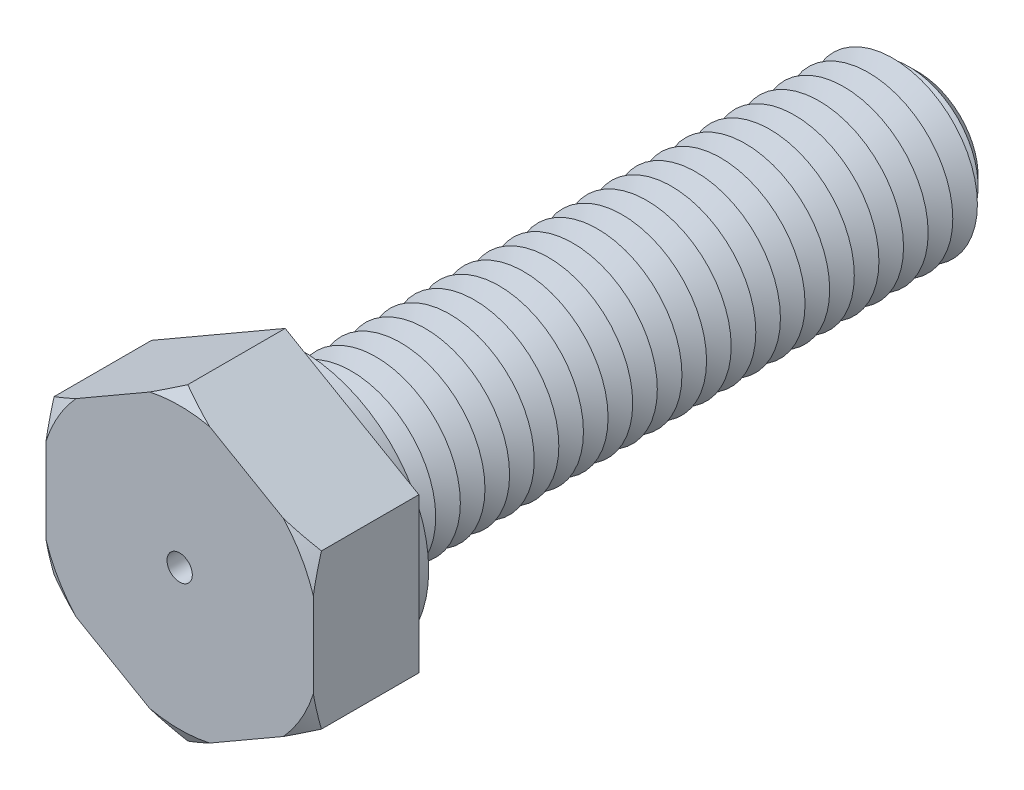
SolidWorks part; units mm, degrees
ref_plane "Front Plane" through (0, 0, 0) normal (0, 0, 1) x (1, 0, 0)
ref_plane "Top Plane" through (0, 0, 0) normal (0, 1, 0) x (1, 0, 0)
ref_plane "Right Plane" through (0, 0, 0) normal (1, 0, 0) x (0, 0, -1)
sketch "Sketch2" plane through (0, 0, 0) normal (0, 0, 1) x (1, 0, 0)
  line L1 (0, 10.9697) -> (-9.5, 5.4848)
  line L2 (-9.5, 5.4848) -> (-9.5, -5.4848)
  line L3 (-9.5, -5.4848) -> (0, -10.9697)
  line L4 (0, -10.9697) -> (9.5, -5.4848)
  line L5 (9.5, -5.4848) -> (9.5, 5.4848)
  line L6 (9.5, 5.4848) -> (0, 10.9697)
  circle A0 centre (0, 0) radius 9.5 construction
  dimension "D1" = 19
extrude "Boss-Extrude1" add sketch "Sketch2" along normal blind 7.5
sketch "Sketch3" plane through (0, 0, 0) normal (0, 0, -1) x (-1, 0, 0)
  circle A0 centre (0, 0) radius 6
  dimension "D1" = 12
extrude "Boss-Extrude2" add sketch "Sketch3" along normal blind 45
sketch "Sketch4" plane through (0, 0, 0) normal (0, 0, -1) x (-1, 0, 0)
  circle A0 centre (0, 0) radius 9
  dimension "D1" = 18
extrude "Boss-Extrude3" add sketch "Sketch4" along normal blind 1.2
sketch "Sketch5" plane through (0, 0, 0) normal (1, 0, 0) x (0, 0, -1)
  line L0 (-3.2117, 0) -> (6.3192, 0) construction
chamfer "Chamfer1" distance 1.75 angle 45 1 edges at (-6, 0, -45)
sketch "Sketch6" plane through (0, 0, 0) normal (1, 0, 0) x (0, 0, -1)
  line L0 (1.2, 6) -> (2.075, 4.4845)
  line L1 (2.075, 4.4845) -> (2.95, 6)
  line L2 (43.25, 6) -> (1.2, 6) construction
  line L3 (2.95, 6) -> (1.2, 6)
  dimension "D1" = 1.75
revolve "Cut-Revolve1" cut sketch "Sketch6" angle 360 about L0
pattern_linear "LPattern1" count 25 spacing 1.75 along (0, 0, -1) of "Cut-Revolve1"
sketch "Sketch7" plane through (0, 0, 0) normal (1, 0, 0) x (0, 0, -1)
  line L0 (-7.5, 10.9697) -> (-7.5, 9.9697)
  line L1 (-7.5, 5.4848) -> (-7.5, 10.9697) construction
  line L2 (-7.5, 9.9697) -> (-6.9226, 10.9697)
  line L3 (-7.5, 10.9697) -> (0, 10.9697) construction
  line L4 (-6.9226, 10.9697) -> (-7.5, 10.9697)
  dimension "D1" = 1
  dimension "D2" = 30
revolve "Cut-Revolve2" cut sketch "Sketch7" angle 360 about L0
sketch "Sketch8" plane through (0, 0, 7.5) normal (0, 0, 1) x (1, 0, 0)
  circle A0 centre (0, 0) radius 0.9
  dimension "D1" = 1.8
extrude "Cut-Extrude1" cut sketch "Sketch8" against normal up to surface (52.5 mm away)
